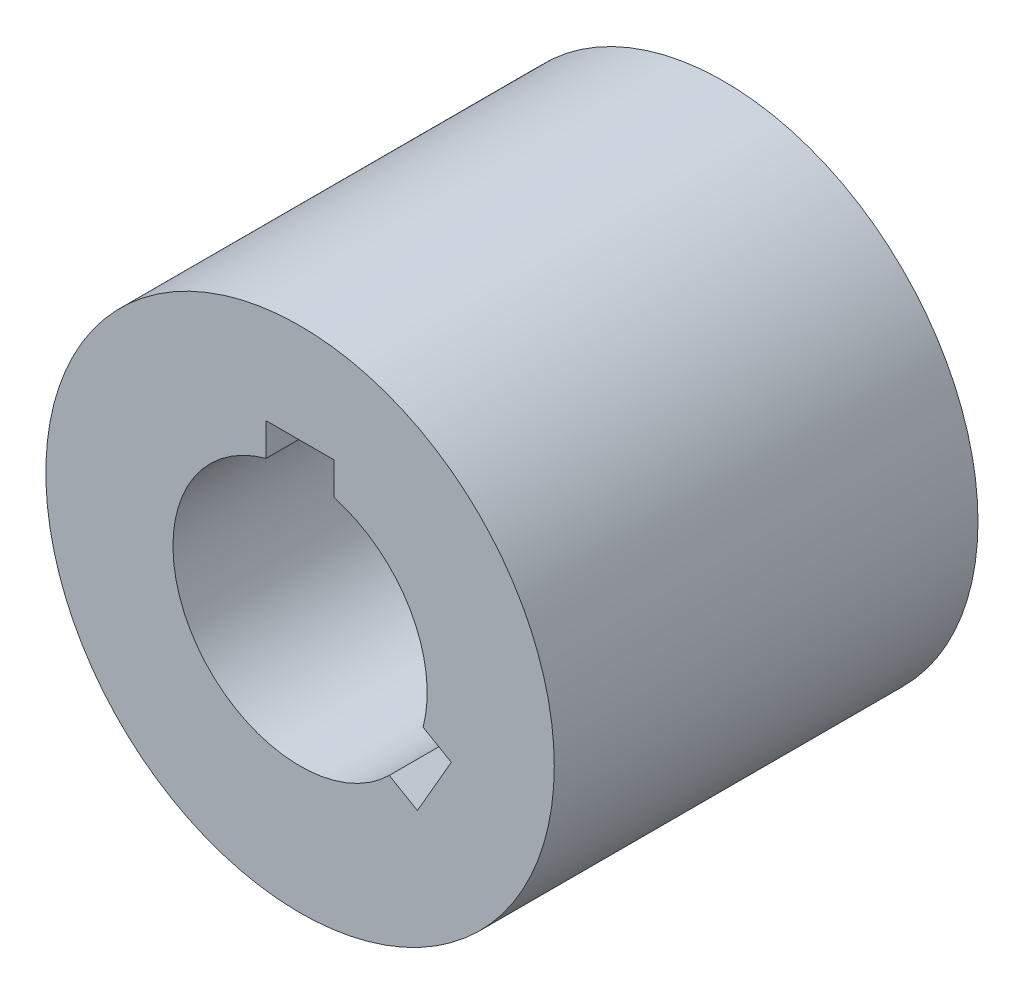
SolidWorks part; units mm, degrees
ref_plane "Plan1" through (0, 0, 0) normal (0, 0, 1) x (1, 0, 0)
ref_plane "Plan2" through (0, 0, 0) normal (0, 1, 0) x (1, 0, 0)
ref_plane "Plan3" through (0, 0, 0) normal (1, 0, 0) x (0, 0, -1)
sketch "Esquisse1" plane through (0, 0, 0) normal (0, 0, 1) x (1, 0, 0)
  line L0 (-4, 18.3) -> (4, 18.3)
  line L1 (4, 18.3) -> (4, 14.4568)
  line L2 (-4, 18.3) -> (-4, 14.4568)
  line L3 (17.8483, -5.6859) -> (14.52, -3.7643)
  line L4 (17.8483, -5.6859) -> (13.8483, -12.6141)
  line L5 (13.8483, -12.6141) -> (10.52, -10.6925)
  line L6 (0, 0) -> (4, 14.4568) construction
  line L7 (0, 0) -> (10.52, -10.6925) construction
  circle A0 centre (0, 0) radius 30
  arc A1 (-4, 14.4568) -> (10.52, -10.6925) centre (0, 0) ccw
  arc A2 (14.52, -3.7643) -> (4, 14.4568) centre (0, 0) ccw
  dimension "D1" = 30
  dimension "D2" = 60
  dimension "D3" = 18.3
  dimension "D4" = 4
  dimension "D5" = 8
  dimension "D6" = 120
extrude "Base-Extrusion" add sketch "Esquisse1" along normal blind 50
